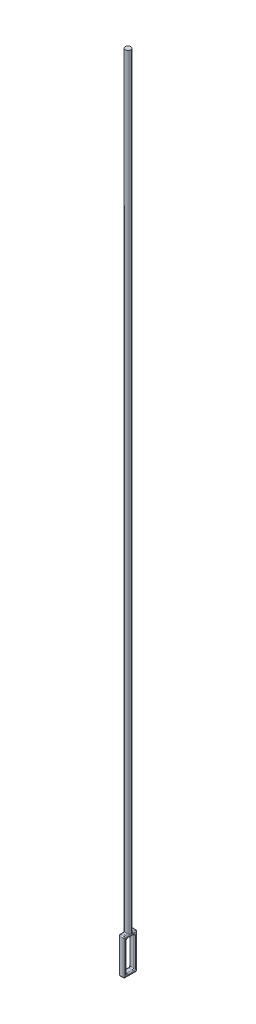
SolidWorks part; units mm, degrees
ref_plane "Front Plane" through (0, 0, 0) normal (0, 0, 1) x (1, 0, 0)
ref_plane "Top Plane" through (0, 0, 0) normal (0, 1, 0) x (1, 0, 0)
ref_plane "Right Plane" through (0, 0, 0) normal (1, 0, 0) x (0, 0, -1)
sketch "Sketch1" plane through (0, 0, 0) normal (0, 0, 1) x (1, 0, 0)
  line L1 (0, 101.6) -> (0.635, 101.6)
  line L2 (0, 101.6) -> (0, 279.4)
  line L3 (0, 279.4) -> (0.635, 279.4)
  line L4 (0.635, 101.6) -> (0.635, 279.4)
  point P4 (0.3175, 279.4)
  dimension "D1" = 177.8
  dimension "D2" = 0.635
revolve "Revolve1" add sketch "Sketch1" angle 360 about L4
sketch "Sketch2" plane through (0, 101.6, 0) normal (0, -1, 0) x (1, 0, 0)
  line L1 (0, -1.5367) -> (1.27, -1.5367)
  line L2 (0, -1.5367) -> (0, 1.5367)
  line L3 (0, 1.5367) -> (1.27, 1.5367)
  line L4 (1.27, -1.5367) -> (1.27, 1.5367)
  dimension "D1" = 1.27
  dimension "D2" = 3.0734
extrude "Boss-Extrude1" add sketch "Sketch2" along normal blind 8.3503
fillet "Fillet1" radius 0.254 14 edges at (1.27, 101.6, 0.7684) (0, 101.6, -0.7683) (0.635, 93.2497, 1.5367) (0, 93.2497, 0) (0.635, 93.2497, -1.5367) (1.27, 93.2497, 0) (0, 97.4249, -1.5367) (1.27, 97.4249, -1.5367) (0, 97.4249, 1.5367) (1.27, 97.4249, 1.5367) (0.635, 101.6, 1.5367) (0.635, 101.6, -1.5367) (1.27, 101.6, -0.7683) (0, 101.6, 0.7683)
fillet "Fillet2" radius 0.254 6 edges at (0.635, 101.6, 0.635) (1.203, 101.6, 0.284) (1.203, 101.6, -0.284) (0.635, 101.6, -0.635) (0.067, 101.6, -0.284) (0.067, 101.6, 0.284)
sketch "Sketch3" plane through (0, 0, 0) normal (-1, 0, 0) x (0, 0, 1)
  line L0 (-1.5367, 93.5037) -> (-1.5367, 101.346) construction
  line L1 (-0.9017, 100.965) -> (0.9017, 100.965)
  line L2 (-0.9017, 100.965) -> (-0.9017, 93.8847)
  line L3 (-0.9017, 93.8847) -> (0.9017, 93.8847)
  line L4 (0.9017, 100.965) -> (0.9017, 93.8847)
  line L5 (1.2827, 93.2497) -> (-1.2827, 93.2497) construction
  dimension "D1" = 1.8034
  dimension "D2" = 7.0802
  dimension "D3" = 0.635
  dimension "D4" = 0.635
extrude "Cut-Extrude1" cut sketch "Sketch3" against normal up to next
fillet "Fillet3" radius 0.254 12 edges at (1.27, 100.965, 0) (0, 100.965, 0) (1.27, 97.4249, 0.9017) (0, 97.4249, 0.9017) (1.27, 97.4249, -0.9017) (0, 97.4249, -0.9017) (0.635, 100.965, -0.9017) (0.635, 100.965, 0.9017) (0.635, 93.8847, 0.9017) (1.27, 93.8847, 0) (0.635, 93.8847, -0.9017) (0, 93.8847, 0)
